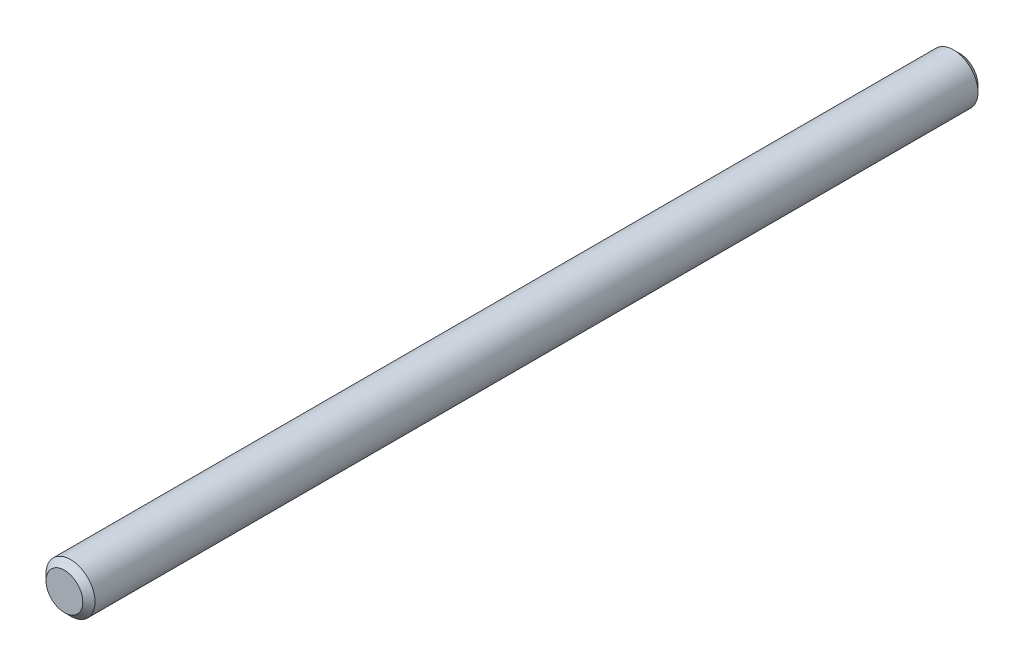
SolidWorks part; units mm, degrees
ref_plane "Frontal" through (0, 0, 0) normal (0, 0, 1) x (1, 0, 0)
ref_plane "Horizontal" through (0, 0, 0) normal (0, 1, 0) x (1, 0, 0)
ref_plane "Vertical" through (0, 0, 0) normal (1, 0, 0) x (0, 0, -1)
sketch "Esquisse1" plane through (0, 0, 0) normal (0, 0, 1) x (1, 0, 0)
  circle A0 centre (12, 12) radius 2
extrude "Base-Extrusion" add sketch "Esquisse1" against normal blind 73
chamfer "Chanfrein1" distance 0.5 angle 45
